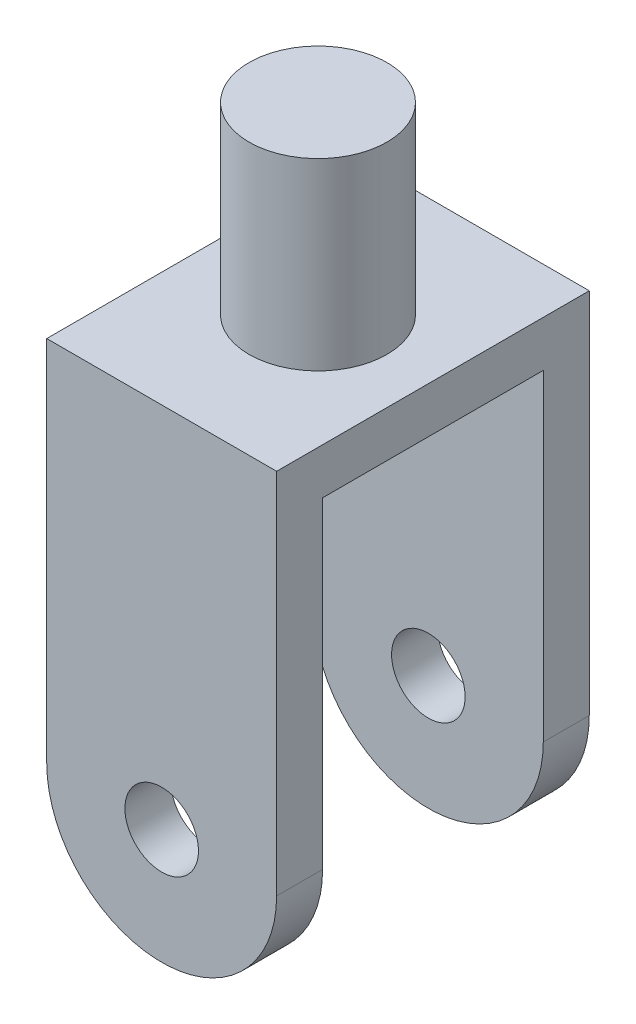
SolidWorks part; units mm, degrees
ref_plane "Front Plane" through (0, 0, 0) normal (0, 0, 1) x (1, 0, 0)
ref_plane "Top Plane" through (0, 0, 0) normal (0, 1, 0) x (1, 0, 0)
ref_plane "Right Plane" through (0, 0, 0) normal (1, 0, 0) x (0, 0, -1)
sketch "Sketch2" plane through (0, 0, 0) normal (0, 0, 1) x (1, 0, 0)
  line L2 (0, 0) -> (0, 101.6)
  line L3 (0, 101.6) -> (63.5, 101.6)
  line L4 (63.5, 0) -> (63.5, 101.6)
  arc A0 (0, 0) -> (63.5, 0) centre (31.75, 0) ccw
  circle A1 centre (31.75, 0) radius 10.16
  dimension "D3" = 20.32
  dimension "D1" = 63.5
  dimension "D2" = 101.6
extrude "Boss-Extrude1" add sketch "Sketch2" along normal blind 86.36
sketch "Sketch3" plane through (63.5, 0, 0) normal (1, 0, 0) x (0, 0, -1)
  line L4 (-73.66, 88.9) -> (-12.7, 88.9)
  line L6 (-73.66, 88.9) -> (-73.66, -31.75)
  line L7 (-86.36, -31.75) -> (0, -31.75) construction
  line L8 (-12.7, -31.75) -> (-12.7, 88.9)
  line L9 (-12.7, 88.9) -> (-73.66, 88.9)
  line L10 (-12.7, -31.75) -> (-73.66, -31.75)
  line L11 (-73.66, -31.75) -> (-12.7, -31.75)
  line L12 (-12.7, 88.9) -> (-73.66, 88.9)
  line L13 (-73.66, 88.9) -> (-73.66, -31.75)
  line L14 (-12.7, 88.9) -> (-12.7, -31.75)
  line L16 (-73.66, 88.9) -> (-12.7, 88.9)
  line L17 (-73.66, 88.9) -> (-73.66, -31.75)
  line L18 (-73.66, -31.75) -> (-12.7, -31.75)
  line L19 (-12.7, 88.9) -> (-12.7, -31.75)
  line L20 (-86.36, 0) -> (-86.36, 101.6) construction
  line L21 (0, 0) -> (0, 101.6) construction
  line L23 (-86.36, 0) -> (-86.36, -31.75) construction
  line L24 (0, -31.75) -> (0, 0) construction
  line L26 (-86.36, 101.6) -> (0, 101.6) construction
  dimension "D1" = 12.7
  dimension "D2" = 12.7
  dimension "D3" = 86.36
  dimension "D4" = 60.96
  dimension "D5" = 12.7
extrude "Cut-Extrude1" cut sketch "Sketch3" against normal through all both and the other way through all contours L17 L16 L19 L18
ref_plane "Plane1" through (63.5, 101.6, 86.36) normal (0, 0, -1) x (-1, 0, 0)
sketch "Sketch5" plane through (0, 101.6, 0) normal (0, 1, 0) x (1, 0, 0)
  line L0 (63.5, 0) -> (0, -86.36)
  circle A0 centre (31.75, -43.18) radius 19.05
  dimension "D1" = 38.1
extrude "Boss-Extrude2" add sketch "Sketch5" along normal blind 50.8 contours A0
